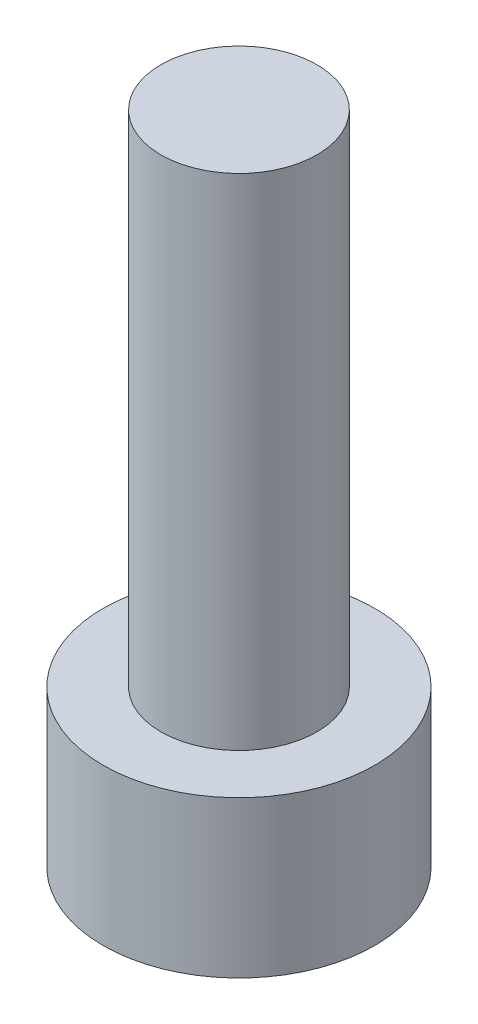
SolidWorks part; units mm, degrees
ref_plane "前视基准面" through (0, 0, 0) normal (0, 0, 1) x (1, 0, 0)
ref_plane "上视基准面" through (0, 0, 0) normal (0, 1, 0) x (1, 0, 0)
ref_plane "右视基准面" through (0, 0, 0) normal (1, 0, 0) x (0, 0, -1)
other "Configuration Table"
sketch "草图1" plane through (0, 0, 0) normal (0, 1, 0) x (1, 0, 0)
  circle A0 centre (0, 0) radius 4.35
  dimension "D1" = 8.7
extrude "凸台-拉伸1" add sketch "草图1" along normal blind 5
sketch "草图2" plane through (0, 5, 0) normal (0, 1, 0) x (1, 0, 0)
  circle A0 centre (0, 0) radius 2.5
  dimension "D1" = 5
extrude "凸台-拉伸2" add sketch "草图2" along normal blind 16
sketch "草图3" plane through (0, 0, 0) normal (0, -1, 0) x (1, 0, 0)
  line L1 (1.5464, -1.7153) -> (2.2586, 0.4816)
  line L2 (2.2586, 0.4816) -> (0.7123, 2.1968)
  line L3 (0.7123, 2.1968) -> (-1.5464, 1.7153)
  line L4 (-1.5464, 1.7153) -> (-2.2586, -0.4816)
  line L5 (-2.2586, -0.4816) -> (-0.7123, -2.1968)
  line L6 (-0.7123, -2.1968) -> (1.5464, -1.7153)
  circle A0 centre (0, 0) radius 2 construction
  dimension "D1" = 4
extrude "切除-拉伸1" cut sketch "草图3" against normal blind 2.5
